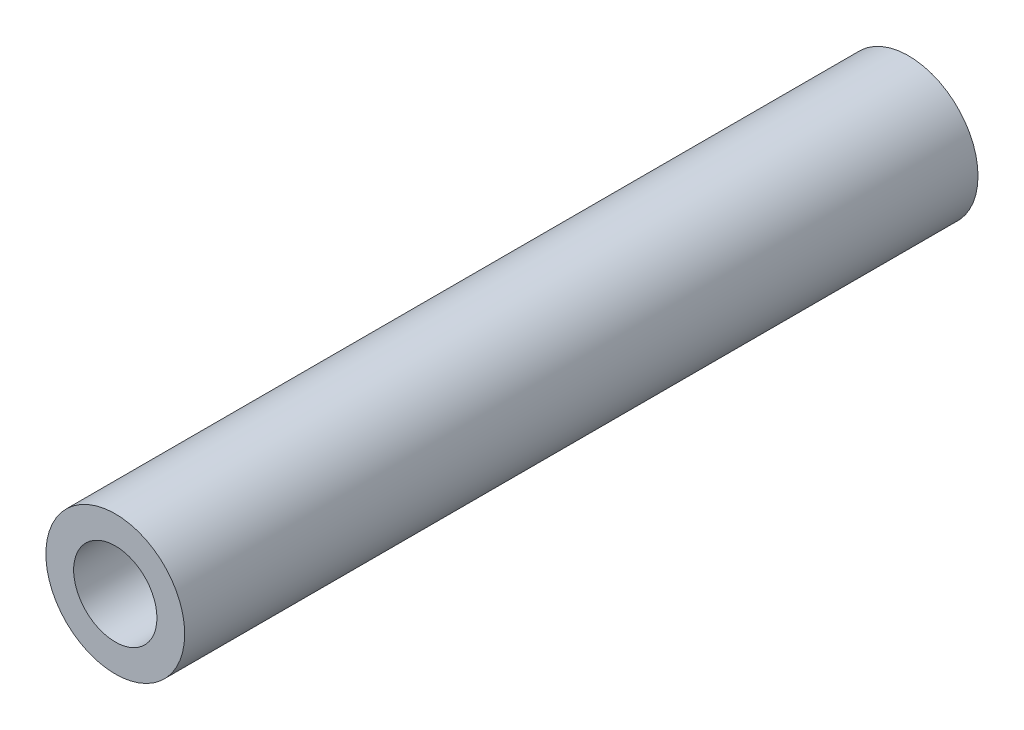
SolidWorks part; units mm, degrees
ref_plane "Front Plane" through (0, 0, 0) normal (0, 0, 1) x (1, 0, 0)
ref_plane "Top Plane" through (0, 0, 0) normal (0, 1, 0) x (1, 0, 0)
ref_plane "Right Plane" through (0, 0, 0) normal (1, 0, 0) x (0, 0, -1)
sketch "Sketch1" plane through (0, 0, 0) normal (0, 0, 1) x (1, 0, 0)
  circle A0 centre (-93.2395, 27.2898) radius 2.1 construction
  circle A1 centre (-93.2395, 27.2898) radius 2.1
  circle A2 centre (-93.2395, 27.2898) radius 3.5
  dimension "D1" = 7
extrude "Boss-Extrude1" add sketch "Sketch1" along normal blind 40
